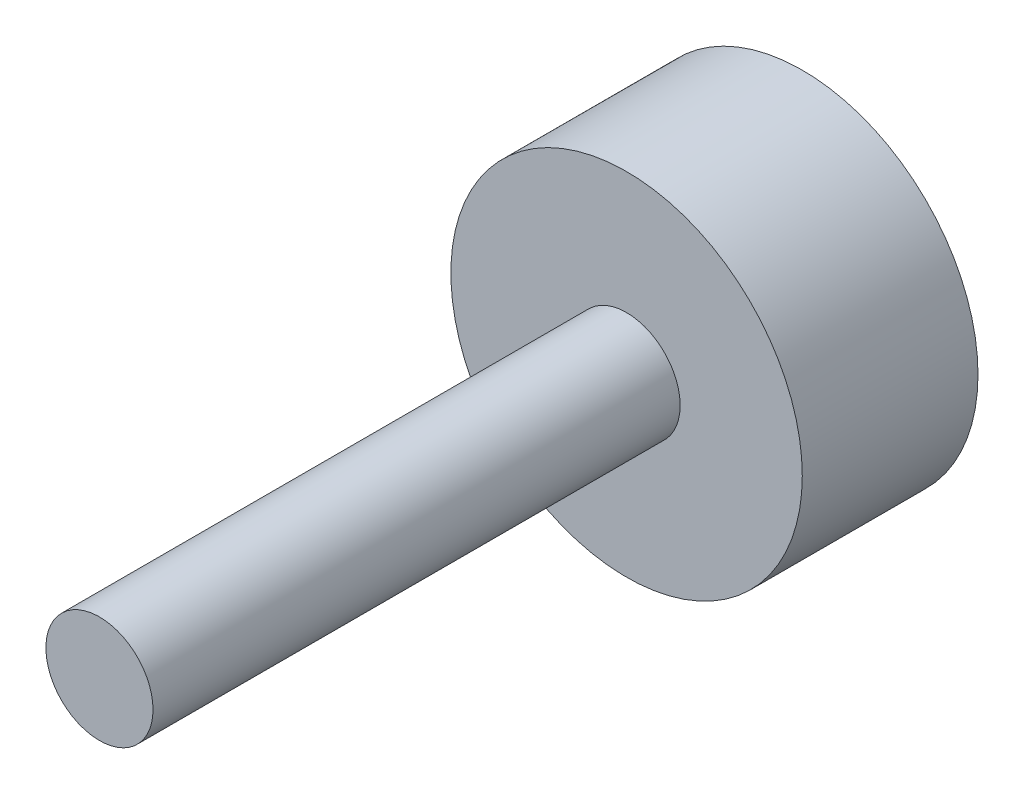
SolidWorks part; units mm, degrees
ref_plane "Front Plane" through (0, 0, 0) normal (0, 0, 1) x (1, 0, 0)
ref_plane "Top Plane" through (0, 0, 0) normal (0, 1, 0) x (1, 0, 0)
ref_plane "Right Plane" through (0, 0, 0) normal (1, 0, 0) x (0, 0, -1)
sketch "Sketch1" plane through (0, 0, 0) normal (0, 0, 1) x (1, 0, 0)
  circle A0 centre (0, 0) radius 5
  dimension "D1" = 10
extrude "Boss-Extrude1" add sketch "Sketch1" along normal blind 5
sketch "Sketch2" plane through (0, 0, 5) normal (0, 0, 1) x (1, 0, 0)
  circle A0 centre (0, 0) radius 1.524
  dimension "D1" = 3.048
extrude "Boss-Extrude2" add sketch "Sketch2" along normal blind 15
